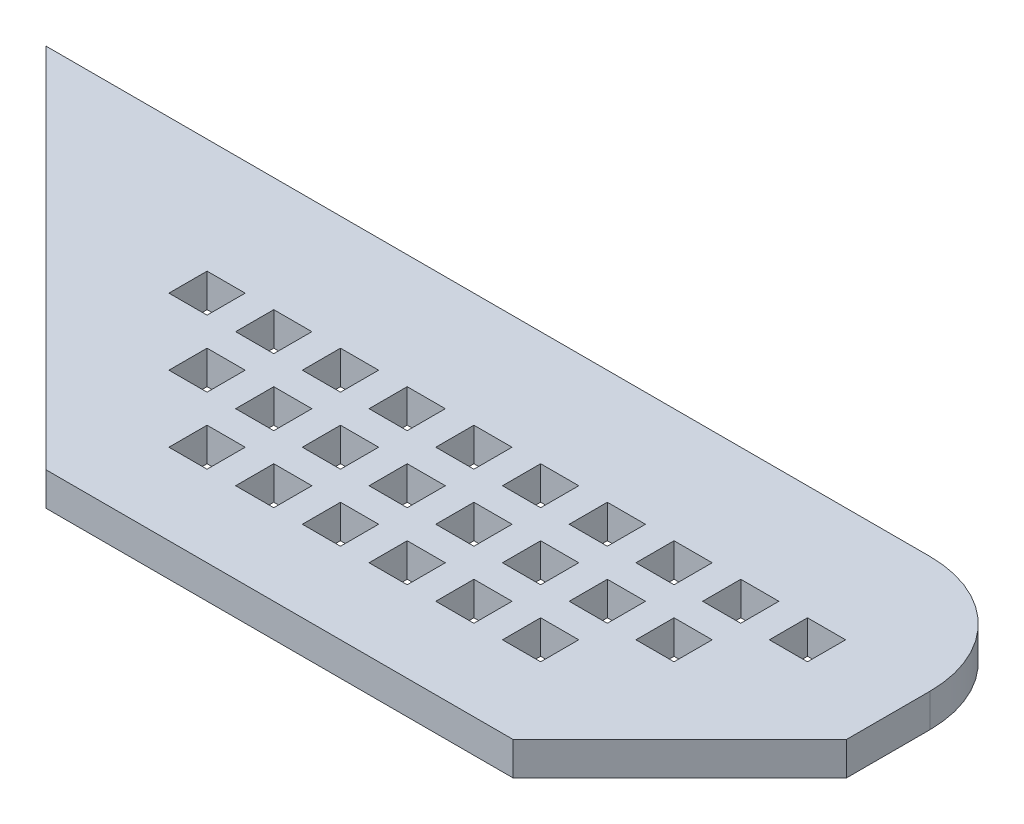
SolidWorks part; units mm, degrees
ref_plane "Front Plane" through (0, 0, 0) normal (0, 0, 1) x (1, 0, 0)
ref_plane "Top Plane" through (0, 0, 0) normal (0, 1, 0) x (1, 0, 0)
ref_plane "Right Plane" through (0, 0, 0) normal (1, 0, 0) x (0, 0, -1)
sketch "Sketch1" plane through (0, 0, 0) normal (0, 1, 0) x (1, 0, 0)
  line L0 (0, 0) -> (140, 0)
  line L1 (140, 0) -> (190, 50)
  line L2 (190, 50) -> (190, 75)
  line L3 (155, 110) -> (-110, 110)
  line L4 (-110, 110) -> (0, 0)
  arc A0 (190, 75) -> (155, 110) centre (155, 75) ccw
  dimension "D4" = 35
  dimension "D1" = 135
  dimension "D2" = 50
  dimension "D3" = 140
  dimension "D5" = 135
  dimension "D6" = 300
extrude "Extrude1" add sketch "Sketch1" along normal blind 10
sketch "Sketch2" plane through (0, 10, 0) normal (0, 1, 0) x (-1, 0, 0)
  line L15 (61.7157, -90) -> (-8.2843, -20)
  line L16 (-8.2843, -20) -> (-131.7157, -20)
  line L17 (-131.7157, -20) -> (-170, -58.2843)
  line L18 (-170, -58.2843) -> (-170, -75)
  line L19 (-155, -90) -> (61.7157, -90)
  line L20 (61.7157, -90) -> (-8.2843, -20)
  line L21 (-8.2843, -20) -> (-131.7157, -20)
  line L22 (-131.7157, -20) -> (-170, -58.2843)
  line L23 (-170, -58.2843) -> (-170, -75)
  line L24 (-155, -90) -> (61.7157, -90)
  arc A2 (-170, -75) -> (-155, -90) centre (-155, -75) ccw
  arc A3 (-170, -75) -> (-155, -90) centre (-155, -75) ccw
  dimension "D1" = 20
sketch "Sketch3" plane through (0, 10, 0) normal (0, 1, 0) x (-1, 0, 0)
  point P0 (41.7157, -70)
  dimension "D1" = 20
  dimension "D2" = 20
other "Fill Pattern2" parameters "D8"=11.431, "D1"=20, "D2"=0, "D3"=0
